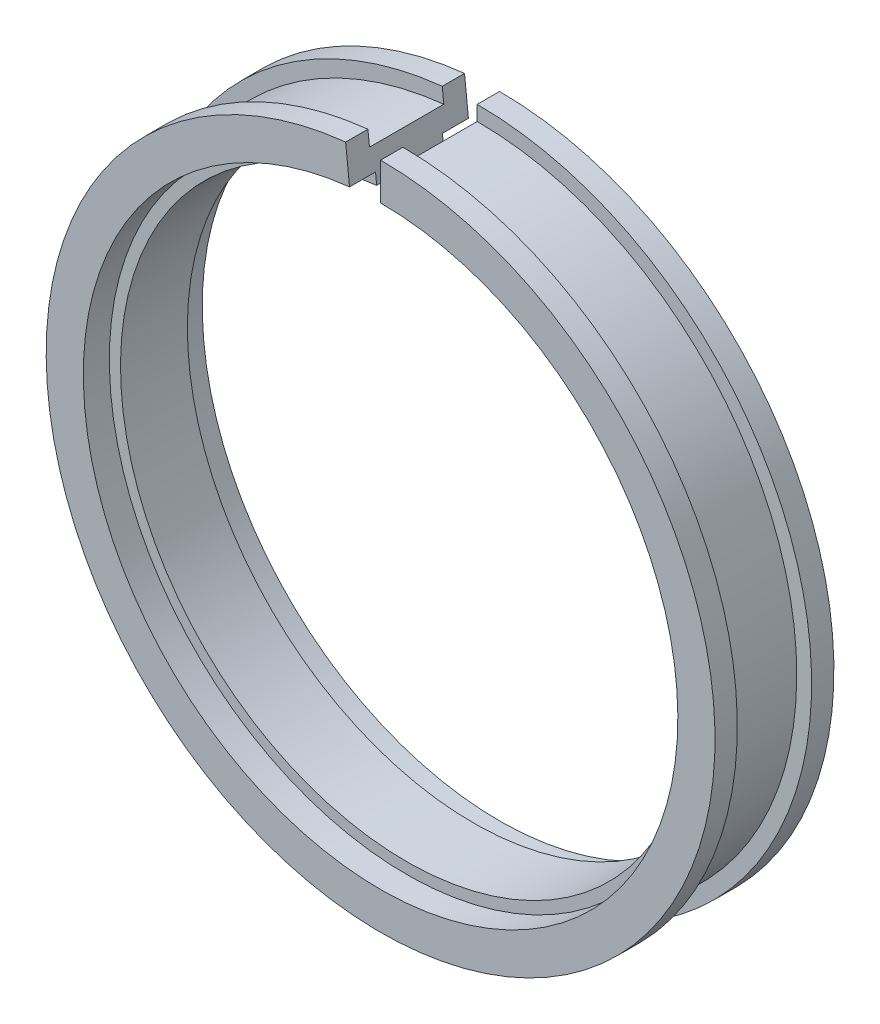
SolidWorks part; units mm, degrees
ref_plane "Plan de face" through (0, 0, 0) normal (0, 0, 1) x (1, 0, 0)
ref_plane "Plan de dessus" through (0, 0, 0) normal (0, 1, 0) x (1, 0, 0)
ref_plane "Plan de droite" through (0, 0, 0) normal (1, 0, 0) x (0, 0, -1)
sketch "Esquisse1" plane through (0, 0, 0) normal (1, 0, 0) x (0, 0, -1)
  line L0 (0, 0) -> (16, 0) construction
  line L1 (0, 40) -> (0, 45)
  line L2 (0, 45) -> (3, 45)
  line L3 (3, 45) -> (3, 43)
  line L4 (3, 43) -> (13, 43)
  line L5 (13, 43) -> (13, 45)
  line L6 (13, 45) -> (16, 45)
  line L7 (16, 45) -> (16, 40)
  line L8 (16, 40) -> (12.5, 40)
  line L9 (12.5, 40) -> (12.5, 38.5)
  line L10 (12.5, 38.5) -> (3.5, 38.5)
  line L11 (3.5, 38.5) -> (3.5, 40)
  line L12 (3.5, 40) -> (0, 40)
  dimension "D1" = 16
  dimension "D2" = 10
  dimension "D3" = 3
  dimension "D4" = 90
  dimension "D5" = 90
  dimension "D6" = 86
  dimension "D7" = 77
  dimension "D8" = 9
  dimension "D9" = 3.5
  dimension "D10" = 80
  dimension "D11" = 80
revolve "Révolution1" add sketch "Esquisse1" angle 354 about L0
